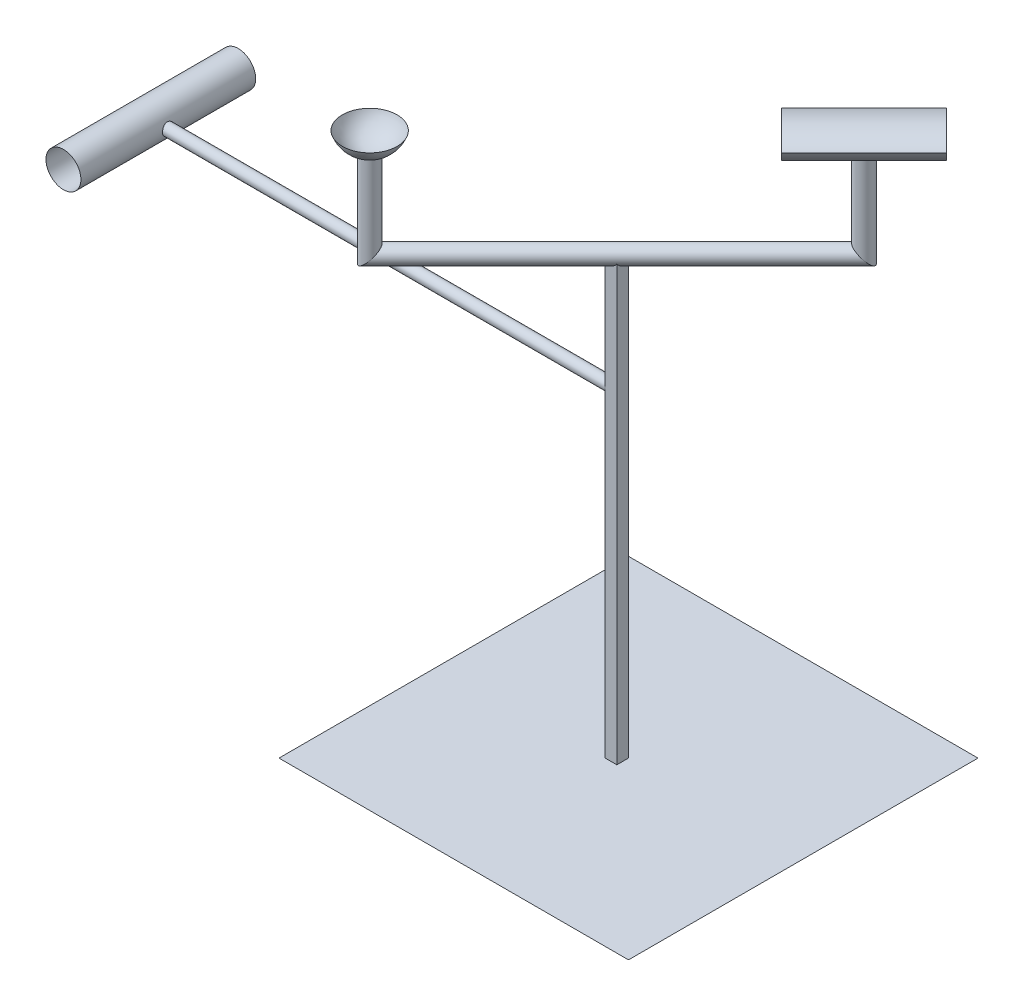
SolidWorks part; units mm, degrees
ref_plane "Plan de face" through (0, 0, 0) normal (0, 0, 1) x (1, 0, 0)
ref_plane "Plan de dessus" through (0, 0, 0) normal (0, 1, 0) x (1, 0, 0)
ref_plane "Plan de droite" through (0, 0, 0) normal (1, 0, 0) x (0, 0, -1)
sketch "Esquisse1" plane through (0, 0, 0) normal (0, 0, 1) x (1, 0, 0)
  line L3 (0, 50) -> (0, 200)
  line L4 (0, 0) -> (-134.1587, 0) construction
  dimension "D1" = 200
  dimension "D4" = 150
ref_plane "Plan2" through (0, 200, 0) normal (0, 1, 0) x (-1, 0, 0)
sketch "Esquisse3" plane through (0, 200, 0) normal (0, 1, 0) x (-1, 0, 0)
  line L0 (2, -2) -> (-2, 2) construction
  line L1 (2, -2) -> (-2, -2)
  line L2 (2, -2) -> (2, 2)
  line L3 (2, 2) -> (-2, 2)
  line L4 (-2, -2) -> (-2, 2)
  dimension "D1" = 45
  dimension "D2" = 4
surface "Surface-Balayage1"
sketch "Esquisse4" plane through (0, 0, 0) normal (0, 0, 1) x (1, 0, 0)
  point P0 (0, 0)
ref_plane "Plan3" through (0, 200, 0) normal (0, 1, 0) x (-1, 0, 0)
sketch "Esquisse5" plane through (0, 200, 0) normal (0, 1, 0) x (-1, 0, 0)
  line L0 (-85.5285, -85.5285) -> (85.5285, 85.5285) construction
  line L1 (0, 0) -> (59.5113, 0) construction
  dimension "D1" = 45
ref_plane "Plan4" through (0, 0, 0) normal (-0.7071, 0, -0.7071) x (-0.7071, 0, 0.7071)
sketch "Esquisse6" plane through (0, 0, 0) normal (-0.7071, 0, -0.7071) x (-0.7071, 0, 0.7071)
  line L0 (60, 230) -> (60, 200)
  line L1 (60, 200) -> (-60, 200)
  line L2 (-60, 200) -> (-60, 230)
  dimension "D1" = 120
  dimension "D2" = 30
  dimension "D3" = 30
ref_plane "Plan5" through (0, 230, 0) normal (0, 1, 0) x (-1, 0, 0)
sketch "Esquisse7" plane through (0, 230, 0) normal (0, 1, 0) x (-1, 0, 0)
  circle A0 centre (-42.4264, -42.4264) radius 3
  dimension "D1" = 6
surface "Surface-Balayage2"
sketch "Esquisse8" plane through (0, 0, 0) normal (-0.7071, 0, -0.7071) x (-0.7071, 0, 0.7071)
  line L0 (-40, 230) -> (-80, 230)
  line L1 (-33.0523, 240) -> (-86.4426, 240) construction
  point P4 (-60, 230)
  dimension "D1" = 240
  dimension "D2" = 20
  dimension "D3" = 40
  dimension "D4" = 60
surface "Surface-Révolution1" sketch "Esquisse8" parameters "D1"=140
sketch "Esquisse9" plane through (0, 0, 0) normal (-0.7071, 0, -0.7071) x (-0.7071, 0, 0.7071)
  line L0 (60, 216.4131) -> (60, 263.5869) construction
  line L2 (60, 240) -> (69.3969, 236.5798) construction
  arc A0 (60, 230) -> (69.3969, 236.5798) centre (60, 240) ccw
  dimension "D1" = 20
  dimension "D2" = 60
  dimension "D3" = 240
  dimension "D4" = 70
surface "Surface-Révolution2" sketch "Esquisse9" parameters "D1"=360
sketch "Esquisse10" plane through (0, 0, 0) normal (-0.7071, 0, -0.7071) x (-0.7071, 0, 0.7071)
  line L0 (60, 240) -> (-80, 240) construction
  dimension "D1" = 60
  dimension "D2" = 240
  dimension "D3" = 140
ref_plane "Plan6" through (0, 150, 0) normal (0, 1, 0) x (-1, 0, 0)
sketch "Esquisse11" plane through (0, 0, 0) normal (1, 0, 0) x (0, 0, -1)
  line L0 (0, 0) -> (0, 160) construction
  circle A0 centre (0, 160) radius 2
  dimension "D2" = 4
  dimension "D1" = 160
surface "Surface-Extrusion1" sketch "Esquisse11" parameters "D1"=160
sketch "Esquisse12" plane through (0, 0, 0) normal (0, 0, 1) x (1, 0, 0)
  line L0 (-160, 158) -> (-160, 162) construction
  circle A0 centre (-160, 160) radius 6
  dimension "D1" = 12
surface "Surface-Extrusion2" sketch "Esquisse12" parameters "D1"=60
ref_plane "Plan7" through (0, 50, 0) normal (0, 1, 0) x (-1, 0, 0)
sketch "Esquisse13" plane through (0, 50, 0) normal (0, 1, 0) x (-1, 0, 0)
  line L0 (58, 58) -> (-62, -62) construction
  line L1 (58, 58) -> (-62, 58)
  line L2 (58, 58) -> (58, -62)
  line L3 (58, -62) -> (-62, -62)
  line L4 (-62, 58) -> (-62, -62)
  dimension "D1" = 45
  dimension "D2" = 120
surface "Surface-Plan1" sketch "Esquisse13"
